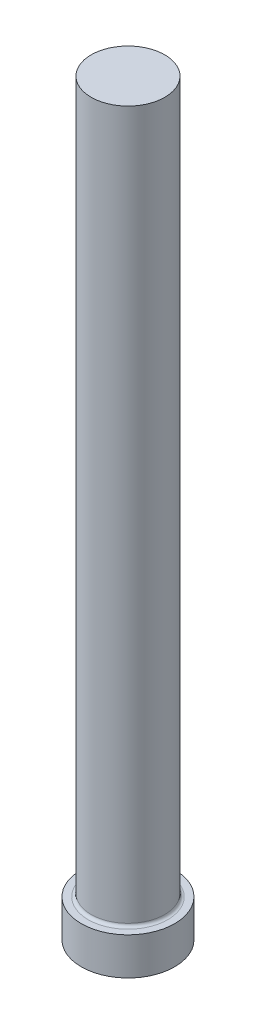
SolidWorks part; units mm, degrees
ref_plane "Front Plane" through (0, 0, 0) normal (0, 0, 1) x (1, 0, 0)
ref_plane "Top Plane" through (0, 0, 0) normal (0, 1, 0) x (1, 0, 0)
ref_plane "Right Plane" through (0, 0, 0) normal (1, 0, 0) x (0, 0, -1)
sketch "Sketch1" plane through (0, 0, 0) normal (0, 0, 1) x (1, 0, 0)
  line L0 (0, 0) -> (0, -1.906) construction
  line L1 (0, 0) -> (3.9624, 0)
  line L2 (3.9624, 0) -> (3.9624, 3.175)
  line L3 (3.9624, 3.175) -> (3.3782, 3.175)
  line L4 (3.1242, 3.429) -> (3.1242, 63.5)
  line L6 (0, 63.5) -> (3.1242, 63.5)
  line L7 (0, 63.5) -> (0, 0)
  arc A0 (3.3782, 3.175) -> (3.1242, 3.429) centre (3.3782, 3.429) cw
  dimension "D5" = 0.254
  dimension "D" = 6.2484
  dimension "H" = 7.9248
  dimension "D4" = 63.5
  dimension "T" = 3.175
revolve "Revolve3" add sketch "Sketch1" angle 360 about L0
